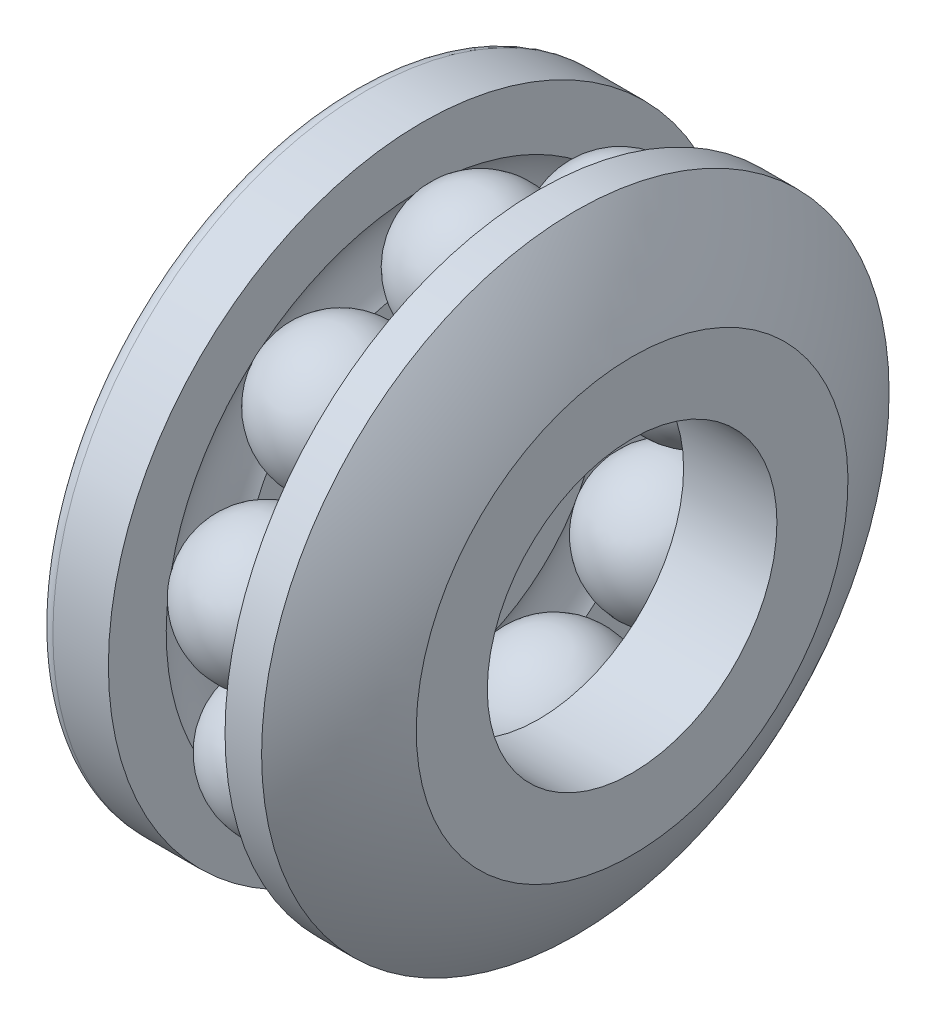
SolidWorks part; units mm, degrees
ref_plane "Front" through (0, 0, 0) normal (0, 0, 1) x (1, 0, 0)
ref_plane "Top" through (0, 0, 0) normal (0, 1, 0) x (1, 0, 0)
ref_plane "Right" through (0, 0, 0) normal (1, 0, 0) x (0, 0, -1)
sketch "Sketch1" plane through (0, 0, 0) normal (0, 0, 1) x (1, 0, 0)
  line L0 (-5.3167, 0) -> (-13.8167, 0) construction
  line L1 (-5.3167, 5) -> (-5.3167, 13)
  line L2 (-5.3167, 13) -> (-2.4167, 13)
  line L3 (-2.4167, 13) -> (-2.4167, 5)
  line L4 (-2.4167, 5) -> (-5.3167, 5)
  line L5 (-13.8167, 13) -> (-13.8167, -10.6089) construction
  line L6 (2.4167, 13) -> (2.4167, 6)
  line L7 (2.4167, 6) -> (6.2833, 6)
  line L8 (6.2833, 6) -> (6.2833, 8.9437)
  line L9 (2.4167, 13) -> (3.9316, 13)
  line L10 (-2.4167, 5) -> (2.4167, 5)
  line L11 (-5.3167, 5) -> (-5.3167, 4.4)
  circle A0 centre (0, 9) radius 2.9
  arc A1 (6.2833, 8.9437) -> (3.9316, 13) centre (-13.8167, 0) ccw
  point P18 (0, 5)
  dimension "qj" = 5.8
  dimension "DR" = 22
  dimension "dd1" = 26
  dimension "D2" = 3.8667
  dimension "xd" = 10
  dimension "1/4dt" = 2.9
  dimension "zj" = 18
  dimension "da" = 8.5
  dimension "dt" = 11.6
  dimension "xd1" = 12
  dimension "dd" = 26
  dimension "xr" = 0.6
revolve "Revolve1" add sketch "Sketch1" angle 360 about L0
sketch "Sketch2" plane through (0, 0, 0) normal (0, 0, 1) x (1, 0, 0)
  line L0 (0, 11.91) -> (0, 6.09)
  line L1 (0, 6.09) -> (0, 13.9953) construction
  arc A0 (0, 11.91) -> (0, 6.09) centre (0, 9) ccw
  dimension "qj" = 5.82
revolve "Revolve2" add sketch "Sketch2" angle 360 about L1
sketch "Sketch3" plane through (0, 0, 0) normal (0, 0, 1) x (1, 0, 0)
  line L0 (6.2833, 6) -> (6.2833, 8.9437) construction
  line L1 (2.4167, 6) -> (6.2833, 6) construction
  line L2 (2.4167, 13) -> (3.9316, 13) construction
  line L3 (2.4167, 13) -> (2.4167, 6) construction
  line L4 (6.2833, 6) -> (6.2833, 8.9437)
  line L5 (2.4167, 6) -> (6.2833, 6)
  line L6 (2.4167, 13) -> (3.9316, 13)
  line L7 (2.4167, 13) -> (2.4167, 10.603)
  line L8 (2.4167, 7.397) -> (2.4167, 6)
  arc A0 (6.2833, 8.9437) -> (3.9316, 13) centre (-13.8167, 0) ccw construction
  circle A1 centre (0, 9) radius 2.9 construction
  arc A2 (6.2833, 8.9437) -> (3.9316, 13) centre (-13.8167, 0) ccw
  arc A3 (2.4167, 7.397) -> (2.4167, 10.603) centre (0, 9) ccw
revolve "Revolve3" add sketch "Sketch3" angle 360 about axis through (-5.3167, 0, 0) along (-1, 0, 0)
fillet "Fillet2" radius 0.6 2 edges at (-5.3167, 5, 0) (-5.3167, 13, 0)
pattern_circular "Circular-Pattern1" count 9 over 360 about axis through (0, 0, 0) along (1, 0, 0) of "Revolve2"
equation "\"1/4dt@Sketch1\" = \"dt@Sketch1\" / 4"
equation "\"qj@Sketch1\" = \"dt@Sketch1\" / 2"
equation "\"zj@Sketch1\" =  ( \"dd1@Sketch1\"  + \"xd@Sketch1\" )  / 2"
equation "\"D2@Sketch1\" = \"dt@Sketch1\" / 3"
equation "\"qj@Sketch2\" = \"qj@Sketch1\"+0.02"
equation "\"D1@Fillet2\" = \"xr@Sketch1\""
equation "\"D1@Circular-Pattern1\" = int( 3.14159265 / atn(( \"qj@Sketch1\"/ 2) / sqr( \"zj@Sketch1\"* \"zj@Sketch1\"/4 - ( \"qj@Sketch1\"/ 2) *  ( \"qj@Sketch1\"/ 2))))"
